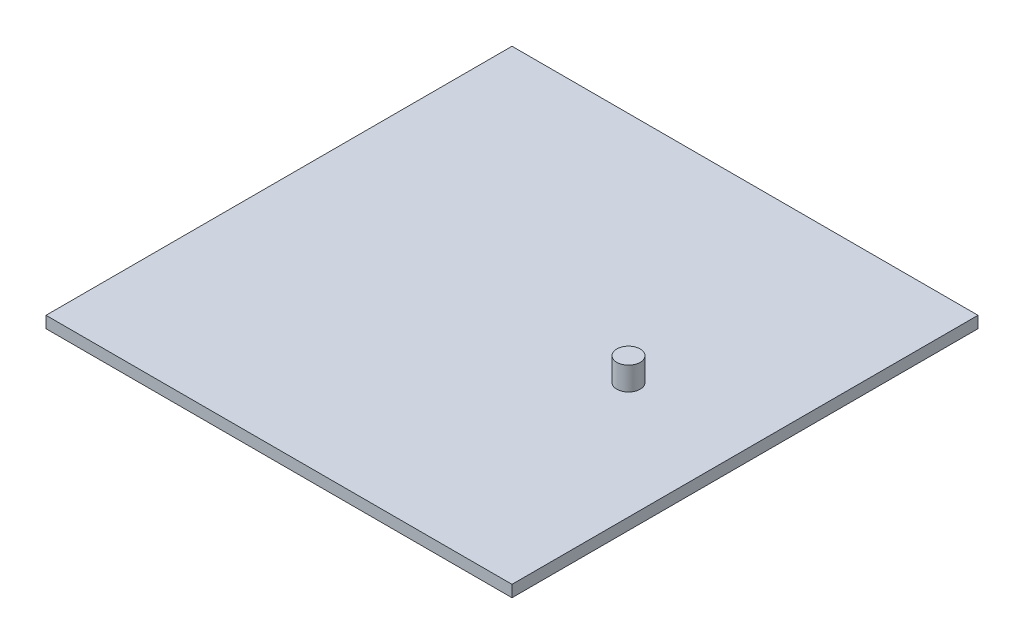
SolidWorks part; units mm, degrees
ref_plane "Front Plane" through (0, 0, 0) normal (0, 0, 1) x (1, 0, 0)
ref_plane "Top Plane" through (0, 0, 0) normal (0, 1, 0) x (1, 0, 0)
ref_plane "Right Plane" through (0, 0, 0) normal (1, 0, 0) x (0, 0, -1)
sketch "Sketch1" plane through (0, 0, 0) normal (0, 1, 0) x (1, 0, 0)
  line L1 (0, 0) -> (200, 0)
  line L2 (0, 0) -> (0, 200)
  line L3 (0, 200) -> (200, 200)
  line L4 (200, 0) -> (200, 200)
  dimension "D1" = 200
  dimension "D2" = 200
extrude "Boss-Extrude1" add sketch "Sketch1" along normal blind 5
sketch "Sketch2" plane through (0, 5, 0) normal (0, 1, 0) x (1, 0, 0)
  line L0 (200, 200) -> (0, 200) construction
  line L1 (200, 0) -> (200, 200) construction
  circle A0 centre (150, 100) radius 5
  dimension "D1" = 10
  dimension "D2" = 100
  dimension "D3" = 50
extrude "Boss-Extrude2" add sketch "Sketch2" along normal blind 10
